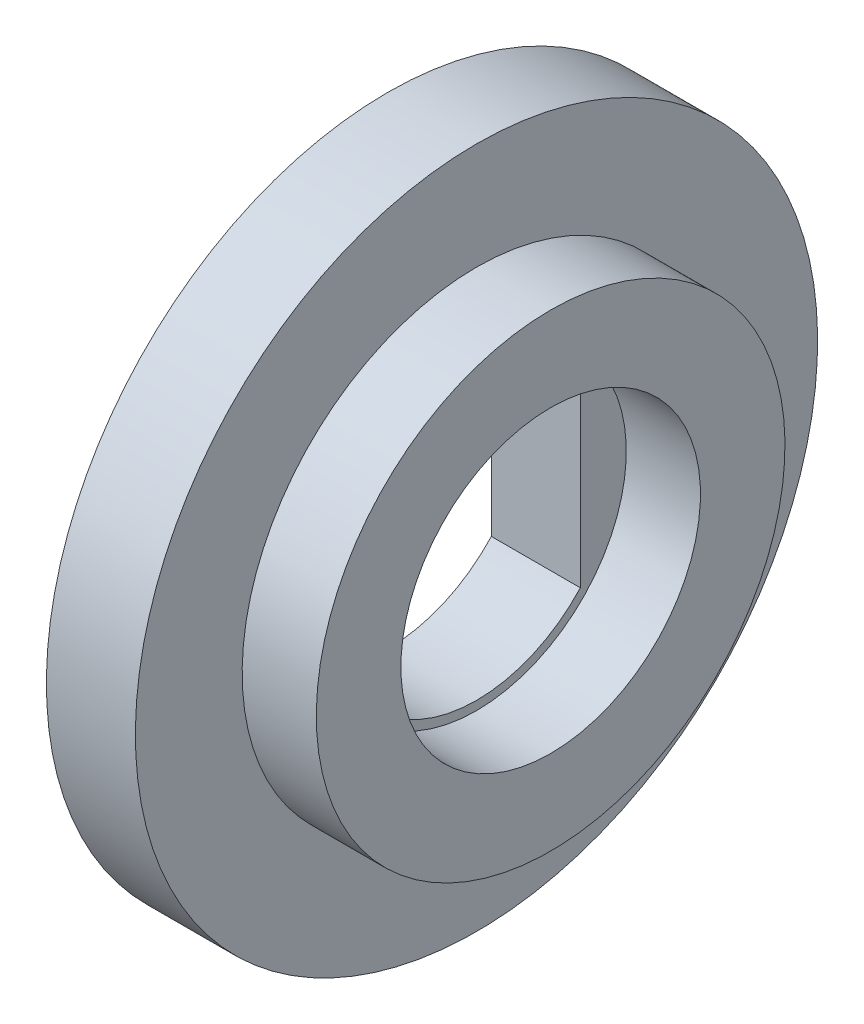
SolidWorks part; units mm, degrees
ref_plane "Plan1" through (0, 0, 0) normal (0, 0, 1) x (1, 0, 0)
ref_plane "Plan2" through (0, 0, 0) normal (0, 1, 0) x (1, 0, 0)
ref_plane "Plan3" through (0, 0, 0) normal (1, 0, 0) x (0, 0, -1)
sketch "Esquisse1" plane through (0, 0, 0) normal (0, 0, 1) x (1, 0, 0)
  line L0 (0, 0) -> (0, 5.85)
  line L1 (0, 11.5) -> (3, 11.5)
  line L2 (3, 11.5) -> (3, 7.9)
  line L3 (3, 7.9) -> (5.5, 7.9)
  line L4 (5.5, 7.9) -> (5.5, 5.05)
  line L5 (5.5, 5.05) -> (3, 5.05)
  line L6 (3, 0) -> (3, 5.05)
  line L7 (0, 0) -> (3, 0)
  line L9 (0, 5.85) -> (1, 5.85)
  line L10 (1, 5.85) -> (1, 9.25)
  line L11 (1, 9.25) -> (0, 9.5179)
  line L12 (11.257, 0) -> (-11.9283, 0) construction
  line L13 (0, 9.5179) -> (0, 11.5)
  dimension "D1" = 11.5
  dimension "D2" = 3
  dimension "D3" = 5.05
  dimension "D4" = 2.5
  dimension "D5" = 2.85
  dimension "D6" = 2.5
  dimension "D8" = 3.4
  dimension "D9" = 1
  dimension "D10" = 105
revolve "Base-Révolution" add sketch "Esquisse1" angle 360 about L12
sketch "Esquisse2" plane through (0, 0, 0) normal (-1, 0, 0) x (0, 0, 1)
  line L0 (0, -7.1595) -> (0, 8.0934) construction
  line L1 (3.5, -3.2113) -> (3.5, 3.2113)
  line L2 (-3.5, -3.2113) -> (-3.5, 3.2113)
  arc A0 (3.5, 3.2113) -> (-3.5, 3.2113) centre (0, 0) ccw
  arc A1 (-3.5, -3.2113) -> (3.5, -3.2113) centre (0, 0) ccw
  dimension "D1" = 9.5
  dimension "D2" = 3.5
extrude "Enlèv. mat.-Extru.1" cut sketch "Esquisse2" against normal through all
